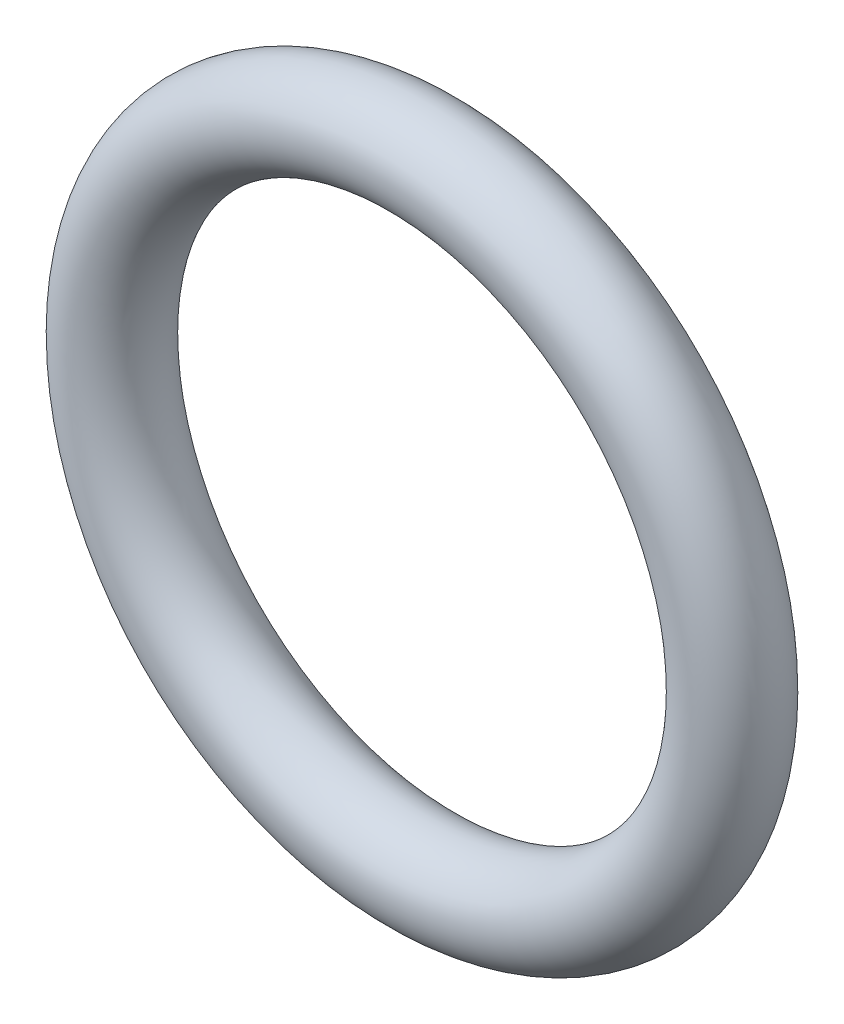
SolidWorks part; units mm, degrees
ref_plane "Спереди" through (0, 0, 0) normal (0, 0, 1) x (1, 0, 0)
ref_plane "Сверху" through (0, 0, 0) normal (0, 1, 0) x (1, 0, 0)
ref_plane "Справа" through (0, 0, 0) normal (1, 0, 0) x (0, 0, -1)
sketch "Эскиз1" plane through (0, 0, 0) normal (0, 0, 1) x (1, 0, 0)
  circle A0 centre (0, 0) radius 5
  point P3 (0, 5)
  point P4 (0, -5)
  dimension "D1" = 10
sketch "Эскиз2" plane through (0, 0, 0) normal (0, 1, 0) x (1, 0, 0)
  circle A0 centre (-5, 0) radius 0.75
  dimension "D1" = 1.5
sweep "По траектории1" add profiles "Эскиз2" path "Эскиз1"
